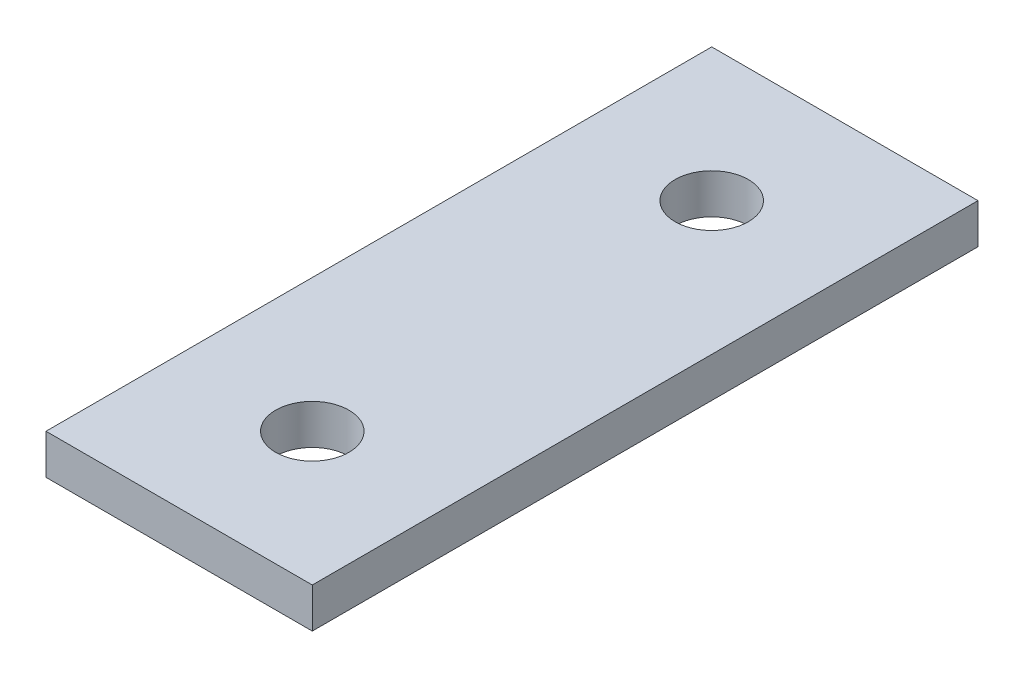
SolidWorks part; units mm, degrees
ref_plane "Front" through (0, 0, 0) normal (0, 0, 1) x (1, 0, 0)
ref_plane "Top" through (0, 0, 0) normal (0, 1, 0) x (1, 0, 0)
ref_plane "Right" through (0, 0, 0) normal (1, 0, 0) x (0, 0, -1)
sketch "Sketch1" plane through (0, 0, 0) normal (0, 1, 0) x (1, 0, 0)
  line L1 (0, 0) -> (20, 0)
  line L2 (0, 0) -> (0, 50)
  line L3 (0, 50) -> (20, 50)
  line L4 (20, 0) -> (20, 50)
  circle A0 centre (10, 40) radius 2.75
  circle A1 centre (10, 10) radius 2.75
extrude "Extrude1" add sketch "Sketch1" along normal blind 3
